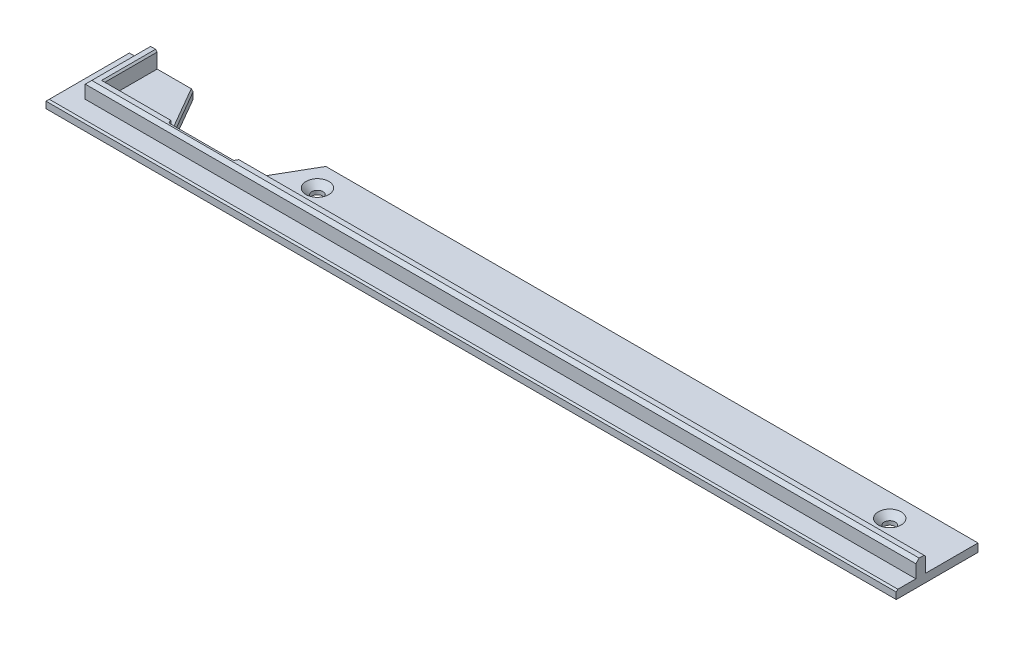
SolidWorks part; units mm, degrees
ref_plane "Ebene vorne" through (0, 0, 0) normal (0, 0, 1) x (1, 0, 0)
ref_plane "Ebene oben" through (0, 0, 0) normal (0, 1, 0) x (1, 0, 0)
ref_plane "Ebene rechts" through (0, 0, 0) normal (1, 0, 0) x (0, 0, -1)
sketch "Skizze1" plane through (0, 0, 0) normal (0, 1, 0) x (1, 0, 0)
  line L1 (-130, -12.5) -> (130, -12.5)
  line L2 (-130, -12.5) -> (-130, 12.5)
  line L3 (-130, 12.5) -> (130, 12.5)
  line L4 (130, -12.5) -> (130, 12.5)
  line L5 (-130, -12.5) -> (130, 12.5) construction
  line L6 (-130, 12.5) -> (130, -12.5) construction
  point P0 (0, 0)
  dimension "D1" = 260
  dimension "D2" = 25
extrude "Aufsatz-Linear austragen1" add sketch "Skizze1" along normal blind 3
sketch "Skizze2" plane through (0, 3, 0) normal (0, 1, 0) x (1, 0, 0)
  line L0 (-130, 12.5) -> (-130, -12.5) construction
  line L1 (-121, -3.5) -> (130, -3.5)
  line L3 (-124, -6.5) -> (130, -6.5)
  line L4 (130, -3.5) -> (130, -6.5)
  line L5 (130, -12.5) -> (130, 12.5) construction
  line L6 (-130, -12.5) -> (130, -12.5) construction
  line L7 (-124, -6.5) -> (-124, 12.5)
  line L8 (130, 12.5) -> (-130, 12.5) construction
  line L9 (-124, 12.5) -> (-121, 12.5)
  line L10 (-121, 12.5) -> (-121, -3.5)
  dimension "D1" = 6
  dimension "D2" = 3
  dimension "D3" = 6
extrude "Aufsatz-Linear austragen2" add sketch "Skizze2" along normal blind 5
chamfer "Fase1" distance 0.5 angle 45 8 edges at (-130, 3, 0) (0, 3, 12.5) (0, 0, -12.5) (-130, 0, 0) (0, 0, 12.5) (130, 0, 0) (4.5, 8, 3.5) (-121, 8, -4.5)
chamfer "Fase2" distance 1 angle 45 2 edges at (3, 8, 6.5) (-124, 8, -3)
hole_wizard "Formsenkung für M3 Senkschraube mit Innensechskant1" positions "Skizze3" profile "Skizze4" countersink size "M3" standard "DIN"
sketch "Skizze3" plane through (0, 3, 0) normal (0, 1, 0) x (1, 0, 0)
  line L0 (130, -12.5) -> (-130, -12.5) construction
  line L2 (-130, -12.5) -> (-130, 12.5) construction
  line L3 (130, -3.5) -> (130, 12.5) construction
  point P0 (110, 5.5)
  point P4 (-65, 5.5)
  dimension "D1" = 18
  dimension "D2" = 20
  dimension "D3" = 65
sketch "Skizze4" plane through (110, 3, -5.5) normal (1, 0, 0) x (0, 0, 1)
  line L0 (0, 0) -> (0, 3)
  line L1 (0, 3) -> (1.7, 3)
  line L2 (1.7, 3) -> (1.7, 1.8)
  line L3 (1.7, 1.8) -> (3.5, 0)
  line L5 (3.5, 0) -> (0, 0)
  line L6 (-1.7, 1.8) -> (-3.5, 0) construction
  line L11 (0, -6.35) -> (0, 107.95) construction
  dimension "Bohrerdurchmesser" = 3.4
  dimension "Bohrungstiefe" = 3
  dimension "Senkdurchmesser (Oben)" = 7
  dimension "Senkwinkel (Oben)" = 90
sketch "Skizze5" plane through (0, 3, 0) normal (0, 1, 0) x (1, 0, 0)
  line L0 (-110, 12.5) -> (-99.8964, -5)
  line L2 (-99.8964, -5) -> (-80.1036, -5)
  line L3 (-80.1036, -5) -> (-70, 12.5)
  line L4 (-70, 12.5) -> (-110, 12.5)
  line L5 (-130, -12.5) -> (-130, 12.5) construction
  line L6 (130, 12.5) -> (-121, 12.5) construction
  dimension "D1" = 60
  dimension "D2" = 60
  dimension "D3" = 17.5
  dimension "D4" = 20
  dimension "D5" = 60
extrude "Schnitt-Linear austragen1" cut sketch "Skizze5" against normal through all both and the other way through all
chamfer "Fase3" distance 0.5 angle 45 5 edges at (-105.3812, 3, -4.5) (-74.6188, 3, -4.5) (-75.1962, 0, -3.5) (-90, 0, 5) (-104.8038, 0, -3.5)
